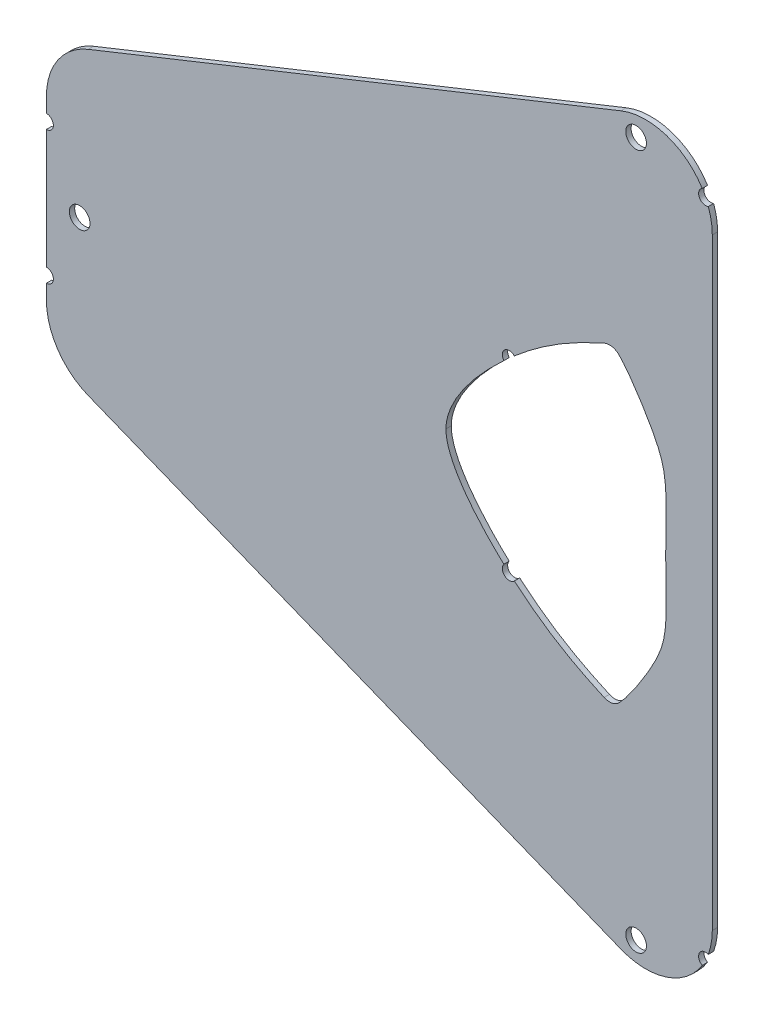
SolidWorks part; units mm, degrees
ref_plane "Plan de face" through (0, 0, 0) normal (0, 0, 1) x (1, 0, 0)
ref_plane "Plan de dessus" through (0, 0, 0) normal (0, 1, 0) x (1, 0, 0)
ref_plane "Plan de droite" through (0, 0, 0) normal (1, 0, 0) x (0, 0, -1)
sketch "Esquisse1" plane through (0, 0, 0) normal (0, 0, 1) x (1, 0, 0)
  line L0 (-12.8896, 0) -> (113.8155, 0) construction
  line L1 (0, 28.2689) -> (0, -8.95) construction
  line L2 (100, 66.1543) -> (100, -74.0345) construction
  line L3 (92.079, 50) -> (129.4811, 50) construction
  line L4 (4.9958, 10) -> (-26.9688, 10) construction
  line L5 (60, 10) -> (60, -30.9866) construction
  line L6 (0, 10) -> (100, 50) construction
  line L7 (0, 13.2297) -> (0, 11.05)
  line L8 (94.1434, 30) -> (136.8699, 30) construction
  line L9 (100, 45.2297) -> (100, 33.256)
  line L10 (-20.9086, 8.4055) -> (132.3051, 69.691) construction
  line L11 (92.079, 60) -> (129.4811, 60) construction
  line L12 (-26.9688, 20) -> (7.2836, 20) construction
  line L13 (86.2861, 54.5144) -> (6.2861, 22.5144)
  line L14 (94.1434, 20) -> (128.1966, 20) construction
  line L15 (100, 20) -> (0, 0) construction
  line L16 (86.2861, -54.5144) -> (6.2861, -22.5144)
  line L17 (100, -45.2297) -> (100, -33.256)
  line L18 (0, 8.95) -> (0, -8.95)
  line L19 (0, -11.05) -> (0, -13.2297)
  line L20 (0, -11.05) -> (0, -58.5509) construction
  line L21 (93, 31.7753) -> (93, -36.0265) construction
  line L23 (100, 33.256) -> (100, -33.256)
  line L24 (85, 34.1629) -> (85, -36.0265) construction
  arc A0 (0, 8.95) -> (0, 11.05) centre (0, 10) ccw
  arc A1 (86.2861, 54.5144) -> (98.4877, 50.5173) centre (90, 45.2297) cw
  arc A2 (70.2754, 14.6325) -> (68.7064, 13.2393) centre (69.5193, 13.9039) ccw
  arc A3 (6.2861, 22.5144) -> (0, 13.2297) centre (10, 13.2297) ccw
  circle A4 centre (5, 0) radius 1.55
  arc A5 (98.4877, 50.5173) -> (99.4038, 48.6309) centre (98.9954, 49.5981) ccw
  arc A6 (83.7532, 23.0403) -> (85.9795, 22.6371) centre (84.5725, 21.2158) cw
  arc A7 (99.4038, 48.6309) -> (100, 45.2297) centre (90, 45.2297) cw
  circle A8 centre (88.559, 52.1925) radius 1.55
  arc A9 (83.7532, -23.0403) -> (85.9795, -22.6371) centre (84.5725, -21.2158) ccw
  arc A10 (70.2754, -14.6325) -> (68.7064, -13.2393) centre (69.5193, -13.9039) cw
  arc A11 (6.2861, -22.5144) -> (0, -13.2297) centre (10, -13.2297) cw
  arc A12 (86.2861, -54.5144) -> (98.4877, -50.5173) centre (90, -45.2297) ccw
  arc A13 (98.4877, -50.5173) -> (99.4038, -48.6309) centre (98.9954, -49.5981) cw
  arc A14 (99.4038, -48.6309) -> (100, -45.2297) centre (90, -45.2297) ccw
  circle A16 centre (88.559, -52.1925) radius 1.55
  arc A19 (0, -8.95) -> (0, -11.05) centre (0, -10) cw
  spline S0 degree 3 poles (83.7532, 23.0403) (79.4383, 21.1027) (75.3219, 18.8505) (70.6637, 14.9651) (70.2754, 14.6325) knots 0.315115 0.315115 0.315115 0.315115 0.617749 0.645174 0.645174 0.645174 0.645174
  spline S1 degree 3 poles (93, 0) (93.1434, 9.1402) (93.5325, 11.899) (87.3548, 21.2757) (85.9795, 22.6371) knots 0 0 0 0 0.584781 0.920625 0.920625 0.920625 0.920625
  spline S2 degree 3 poles (68.7064, 13.2393) (64.2193, 9.1086) (60.0184, 3.9285) (60, 0) knots 0.682097 0.682097 0.682097 0.682097 1 1 1 1
  spline S3 degree 3 poles (93, 0) (93.1434, -9.1402) (93.5325, -11.899) (87.3548, -21.2757) (85.9795, -22.6371) knots 0 0 0 0 0.584781 0.920625 0.920625 0.920625 0.920625
  spline S4 degree 3 poles (83.7532, -23.0403) (79.4383, -21.1027) (75.3219, -18.8505) (70.6637, -14.9651) (70.2754, -14.6325) knots 0.315115 0.315115 0.315115 0.315115 0.617749 0.645174 0.645174 0.645174 0.645174
  spline S5 degree 3 poles (68.7064, -13.2393) (64.2193, -9.1086) (60.0184, -3.9285) (60, 0) knots 0.682097 0.682097 0.682097 0.682097 1 1 1 1
  point P22 (100, 50)
  point P25 (0, 10)
  point P39 (0, 20)
  point P40 (100, 60)
  point P45 (0, 0)
  dimension "D1" = 10
  dimension "D2" = 2
  dimension "D4" = 3
  dimension "D3" = 10
extrude "Extrusion1" add sketch "Esquisse1" along normal blind 0.8
